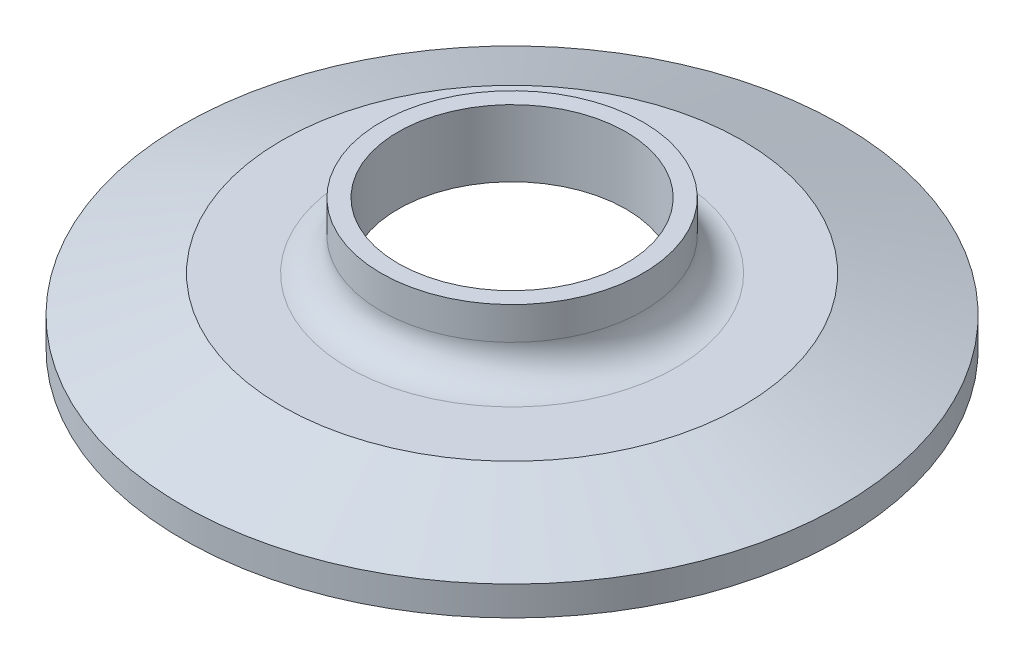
SolidWorks part; units mm, degrees
ref_plane "Front Plane" through (0, 0, 0) normal (0, 0, 1) x (1, 0, 0)
ref_plane "Top Plane" through (0, 0, 0) normal (0, 1, 0) x (1, 0, 0)
ref_plane "Right Plane" through (0, 0, 0) normal (1, 0, 0) x (0, 0, -1)
sketch "Sketch1" plane through (0, 0, 0) normal (0, 0, 1) x (1, 0, 0)
  line L0 (0, 0) -> (0, 8.8532) construction
  line L1 (-12.7, 12.7) -> (-12.7, 9.525)
  line L2 (-15.875, 6.35) -> (-22.3227, 6.35)
  line L3 (-22.3227, 6.35) -> (-31.9532, 2.8448)
  line L4 (-31.9532, 2.8448) -> (-31.9532, 0)
  line L5 (-31.9532, 0) -> (-30.1592, 0.0025)
  line L6 (-23.749, 0) -> (-26.178, 0.0025)
  line L10 (-23.749, 0) -> (-11.049, 6.2189)
  line L11 (-11.049, 6.2189) -> (-11.049, 12.7)
  line L12 (-11.049, 12.7) -> (-12.7, 12.7)
  line L15 (-29.2675, 0.8754) -> (-29.4344, 0.4823)
  line L17 (-27.0697, 0.8754) -> (-26.9028, 0.4823)
  arc A0 (-15.875, 6.35) -> (-12.7, 9.525) centre (-15.875, 9.525) ccw
  arc A1 (-29.4344, 0.4823) -> (-30.1592, 0.0025) centre (-30.1592, 0.7899) cw
  arc A2 (-26.178, 0.0025) -> (-26.9028, 0.4823) centre (-26.178, 0.7899) cw
  arc A3 (-27.0697, 0.8754) -> (-29.2675, 0.8754) centre (-28.1686, 0.4089) ccw
  dimension "D3" = 3.175
  dimension "D7" = 0.7874
  dimension "D8" = 28.1686
  dimension "D9" = 0.7874
  dimension "D2" = 11.049
  dimension "D4" = 12.7
  dimension "D5" = 6.35
  dimension "D6" = 31.9532
  dimension "D10" = 20
  dimension "D11" = 23.749
  dimension "D12" = 12.7
  dimension "D13" = 2.8448
  dimension "D14" = 63.91
revolve "Revolve1" add sketch "Sketch1" angle 360 about L0
